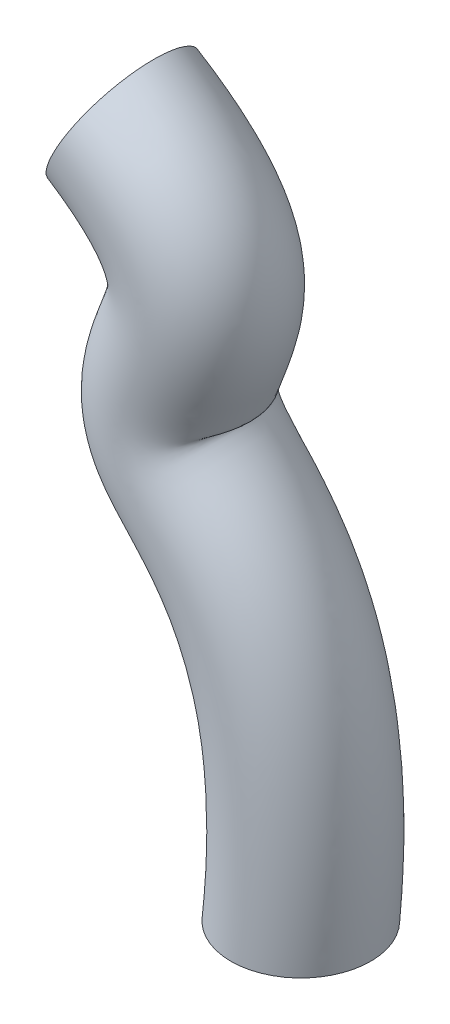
SolidWorks part; units mm, degrees
ref_plane "Front Plane" through (0, 0, 0) normal (0, 0, 1) x (1, 0, 0)
ref_plane "Top Plane" through (0, 0, 0) normal (0, 1, 0) x (1, 0, 0)
ref_plane "Right Plane" through (0, 0, 0) normal (1, 0, 0) x (0, 0, -1)
sketch "Sketch1" plane through (0, 0, 0) normal (0, 0, 1) x (1, 0, 0)
  spline S0 degree 3 poles (0, 0) (3.7222, 35.4959) (-35.2368, 56.4632) (-0.6783, 68.8682) (-24.5547, 84.048) knots 0 0 0 0 0.359969 1 1 1 1
sketch "Sketch7" plane through (0, 0, 0) normal (0, 1, 0) x (1, 0, 0)
  circle A0 centre (0, 0) radius 9.6326
  dimension "D1" = 19.2651
sweep "Sweep3" add profiles "Sketch7" path "Sketch1"
sketch "Sketch3" plane through (0, 0, 0) normal (0, 1, 0) x (1, 0, 0)
